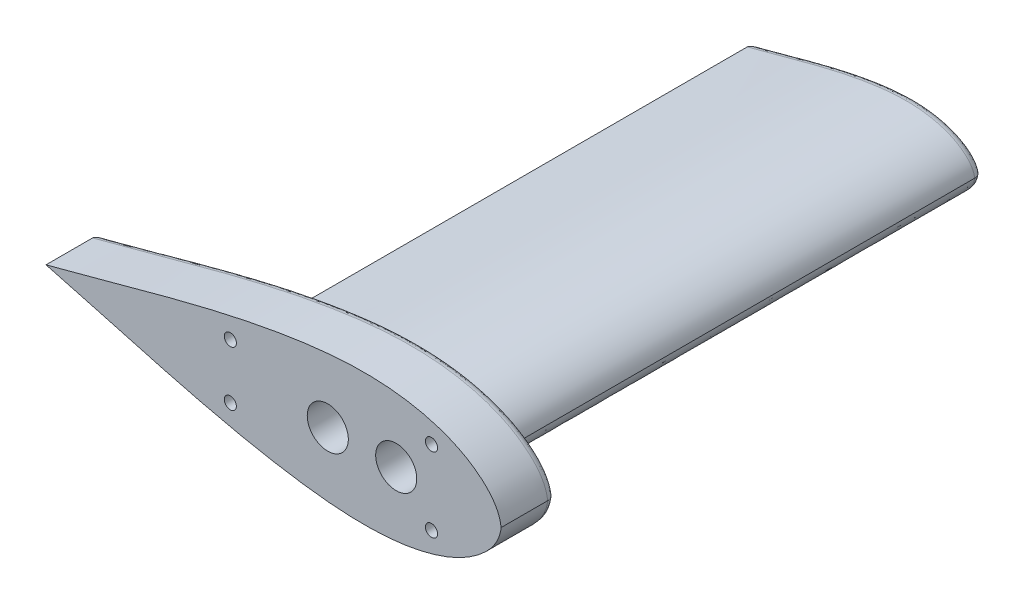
SolidWorks part; units mm, degrees
ref_plane "Front Plane" through (0, 0, 0) normal (0, 0, 1) x (1, 0, 0)
ref_plane "Top Plane" through (0, 0, 0) normal (0, 1, 0) x (1, 0, 0)
ref_plane "Right Plane" through (0, 0, 0) normal (1, 0, 0) x (0, 0, -1)
sketch "Sketch4" plane through (0, 0, 0) normal (0, 0, 1) x (1, 0, 0)
  line L0 (0, 0) -> (-177.8, 0) construction
  spline S0 degree 3 poles (0, 0) (-0.6675, 6.3742) (-10.0565, 17.9766) (-31.7561, 27.884) (-61.5897, 31.8487) (-122.9952, 25.9037) (-172.9666, 9.8511) (-211.1375, 0) knots 0 0 0 0 0.081723 0.187554 0.308904 0.476646 1 1 1 1
  spline S1 degree 3 poles (0, 0) (-0.6675, -6.3742) (-10.0565, -17.9766) (-31.7561, -27.884) (-61.5897, -31.8487) (-122.9952, -25.9037) (-172.9666, -9.8511) (-211.1375, 0) knots 0 0 0 0 0.081723 0.187554 0.308904 0.476646 1 1 1 1
extrude "Boss-Extrude3" add sketch "Sketch4" along normal blind 25.4
sketch "Sketch5" plane through (0, 0, 0) normal (0, 0, -1) x (-1, 0, 0)
  line L0 (0, 0) -> (211.1375, 0) construction
  spline S2 degree 3 poles (30.5264, 0) (30.8599, 3.1852) (35.5516, 8.9829) (46.3949, 13.9336) (61.3027, 15.9147) (91.987, 12.944) (116.9576, 4.9226) (136.0316, 0) knots 0 0 0 0 0.081723 0.187554 0.308904 0.476646 1 1 1 1
  spline S3 degree 3 poles (136.0316, 0) (116.9576, -4.9226) (91.987, -12.944) (61.3027, -15.9147) (46.3949, -13.9336) (35.5516, -8.9829) (30.8599, -3.1852) (30.5264, 0) knots 0 0 0 0 0.523354 0.691096 0.812446 0.918277 1 1 1 1
extrude "Boss-Extrude4" add sketch "Sketch5" along normal blind 228.6
hole_wizard "CBORE for #10 Socket Head Cap Screw1" positions "Sketch12" profile "Sketch13" counterbore size "#10" standard "ANSI Inch"
sketch "Sketch12" plane through (0, 0, 0) normal (0, 0, -1) x (-1, 0, 0)
  line L0 (0, 0) -> (211.1375, 0) construction
  point P0 (32.3086, 17.272)
  point P4 (125.6318, 12.7)
  point P6 (125.6318, -12.7)
  point P10 (32.3086, -17.272)
  dimension "D1" = 12.7
  dimension "D3" = 17.272
sketch "Sketch13" plane through (-32.3086, 17.272, 0) normal (1, 0, 0) x (0, 1, 0)
  line L0 (0, 0) -> (0, 25.4)
  line L1 (0, 25.4) -> (2.8067, 25.4)
  line L3 (2.8067, 25.4) -> (2.8067, 4.826)
  line L4 (4.7625, 4.826) -> (2.8067, 4.826)
  line L5 (4.7625, 4.826) -> (4.7625, 0.635)
  line L6 (4.7625, 0.635) -> (5.3975, 0)
  line L7 (5.3975, 0) -> (0, 0)
  line L8 (-4.7625, 0.635) -> (-5.3975, 0) construction
  line L11 (0, -6.35) -> (0, 107.95) construction
  dimension "Thru Hole Dia." = 5.6134
  dimension "Thru Hole Depth" = 25.4
  dimension "C'Bore Dia." = 9.525
  dimension "C'Bore Depth" = 4.826
  dimension "Near C'Sink Dia." = 10.795
  dimension "Near C'Sink Angle" = 90
fillet "Fillet1" radius 3.81 2 edges
fillet "Fillet2" radius 3.81 2 edges
fillet "Fillet3" radius 3.81 2 edges
sketch "Sketch14" plane through (0, 0, -228.6) normal (0, 0, -1) x (-1, 0, 0)
  line L0 (121.3424, 0) -> (34.3738, 0) construction
  circle A0 centre (48.6688, 0) radius 9.525
  circle A1 centre (80.4188, 0) radius 9.525
  spline S0 degree 3 poles (34.3738, 0) (34.4656, -0.4859) (34.6288, -0.9442) (35.0577, -1.8156) (35.3262, -2.2326) (35.914, -3.0067) (36.2352, -3.3682) (36.9149, -4.0564) (37.2735, -4.3828) (38.0185, -5.0099) (38.4034, -5.3093) (39.1871, -5.8756) (39.5871, -6.1436) (40.8094, -6.9067) (41.6537, -7.361) (43.3906, -8.1808) (44.2832, -8.5461) (46.1083, -9.2031) (47.032, -9.4918) (49.8247, -10.2598) (51.7209, -10.6393) (55.5564, -11.1819) (57.4708, -11.3423) (61.2948, -11.4993) (63.2044, -11.4956) (68.9274, -11.2887) (72.735, -10.8905) (78.4404, -10.086) (80.3398, -9.7847) (84.1221, -9.1295) (86.0069, -8.7748) (91.6453, -7.642) (95.3828, -6.7951) (106.5539, -4.0777) (113.9462, -2.0305) (121.3424, 0) knots 0 0 0 0 0.015625 0.015625 0.03125 0.03125 0.046875 0.046875 0.0625 0.0625 0.078125 0.078125 0.09375 0.09375 0.125 0.125 0.15625 0.15625 0.1875 0.1875 0.25 0.25 0.3125 0.3125 0.375 0.375 0.5 0.5 0.5625 0.5625 0.625 0.625 0.75 0.75 1 1 1 1 construction
  spline S1 degree 3 poles (121.3424, 0) (113.946, 2.0305) (106.5536, 4.0777) (95.3823, 6.7953) (91.6447, 7.6421) (86.0062, 8.7749) (84.1213, 9.1296) (80.339, 9.7849) (78.4395, 10.0862) (72.7341, 10.8906) (68.9264, 11.2888) (63.2033, 11.4956) (61.2937, 11.4993) (57.4696, 11.3422) (55.5551, 11.1818) (51.7196, 10.639) (49.8233, 10.2595) (47.0306, 9.4914) (46.1069, 9.2026) (44.2817, 8.5456) (43.3891, 8.1802) (41.6523, 7.3603) (40.808, 6.9059) (39.5857, 6.1427) (39.1857, 5.8747) (38.4021, 5.3083) (38.0172, 5.0089) (37.2722, 4.3817) (36.9136, 4.0552) (36.2341, 3.3669) (35.9129, 3.0054) (35.3252, 2.2312) (35.0568, 1.814) (34.6283, 0.9429) (34.4656, 0.4861) (34.3738, 0) knots 0 0 0 0 0.25 0.25 0.375 0.375 0.4375 0.4375 0.5 0.5 0.625 0.625 0.6875 0.6875 0.75 0.75 0.8125 0.8125 0.84375 0.84375 0.875 0.875 0.90625 0.90625 0.921875 0.921875 0.9375 0.9375 0.953125 0.953125 0.96875 0.96875 0.984375 0.984375 1 1 1 1 construction
  dimension "D1" = 19.05
  dimension "D2" = 31.75
extrude "Cut-Extrude1" cut sketch "Sketch14" against normal up to next
